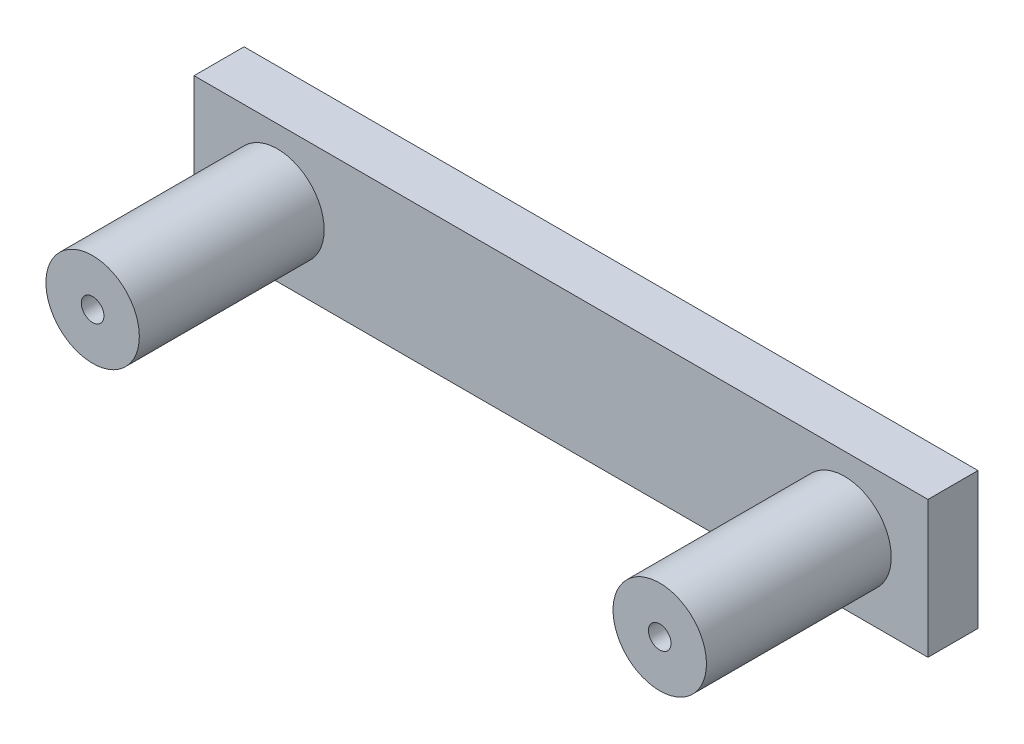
SolidWorks part; units mm, degrees
ref_plane "Front Plane" through (0, 0, 0) normal (0, 0, 1) x (1, 0, 0)
ref_plane "Top Plane" through (0, 0, 0) normal (0, 1, 0) x (1, 0, 0)
ref_plane "Right Plane" through (0, 0, 0) normal (1, 0, 0) x (0, 0, -1)
sketch "Sketch1" plane through (0, 0, 0) normal (0, 0, 1) x (1, 0, 0)
  line L0 (-69.85, 13.0175) -> (69.85, -13.0175) construction
  line L2 (-69.85, 13.0175) -> (69.85, 13.0175)
  line L3 (-69.85, 13.0175) -> (-69.85, -13.0175)
  line L4 (-69.85, -13.0175) -> (69.85, -13.0175)
  line L5 (69.85, 13.0175) -> (69.85, -13.0175)
  dimension "D1" = 26.035
  dimension "D2" = 139.7
extrude "Boss-Extrude1" add sketch "Sketch1" along normal blind 9.525
sketch "Sketch2" plane through (0, 0, 9.525) normal (0, 0, 1) x (1, 0, 0)
  line L0 (0, 0) -> (-53.975, 0) construction
  line L1 (0, 0) -> (53.975, 0) construction
  circle A0 centre (-53.975, 0) radius 8.89
  circle A1 centre (53.975, 0) radius 8.89
  dimension "D1" = 17.78
  dimension "D2" = 107.95
extrude "Boss-Extrude2" add sketch "Sketch2" along normal blind 35.179
hole_wizard "CBORE for #8 Socket Head Cap Screw1" positions "Sketch4" profile "Sketch3" counterbore size "#8" standard "Ansi Inch"
sketch "Sketch4" plane through (0, 0, 0) normal (0, 0, -1) x (-1, 0, 0)
  circle A0 centre (53.975, 0) radius 8.89 construction
  circle A1 centre (-53.975, 0) radius 8.89 construction
  point P0 (53.975, 0)
  point P1 (-53.975, 0)
sketch "Sketch3" plane through (-53.975, 0, 0) normal (1, 0, 0) x (0, 1, 0)
  line L0 (0, 0) -> (0, 44.704)
  line L1 (0, 44.704) -> (2.1526, 44.704)
  line L3 (2.1526, 44.704) -> (2.1526, 6.35)
  line L4 (2.1526, 6.35) -> (3.9687, 6.35)
  line L5 (3.9687, 6.35) -> (3.9687, 0)
  line L7 (3.9687, 0) -> (0, 0)
  line L11 (0, -6.35) -> (0, 107.95) construction
  dimension "Thru Hole Dia." = 4.3053
  dimension "Thru Hole Depth" = 44.704
  dimension "C'Bore Dia." = 7.9375
  dimension "C'Bore Depth" = 6.35
